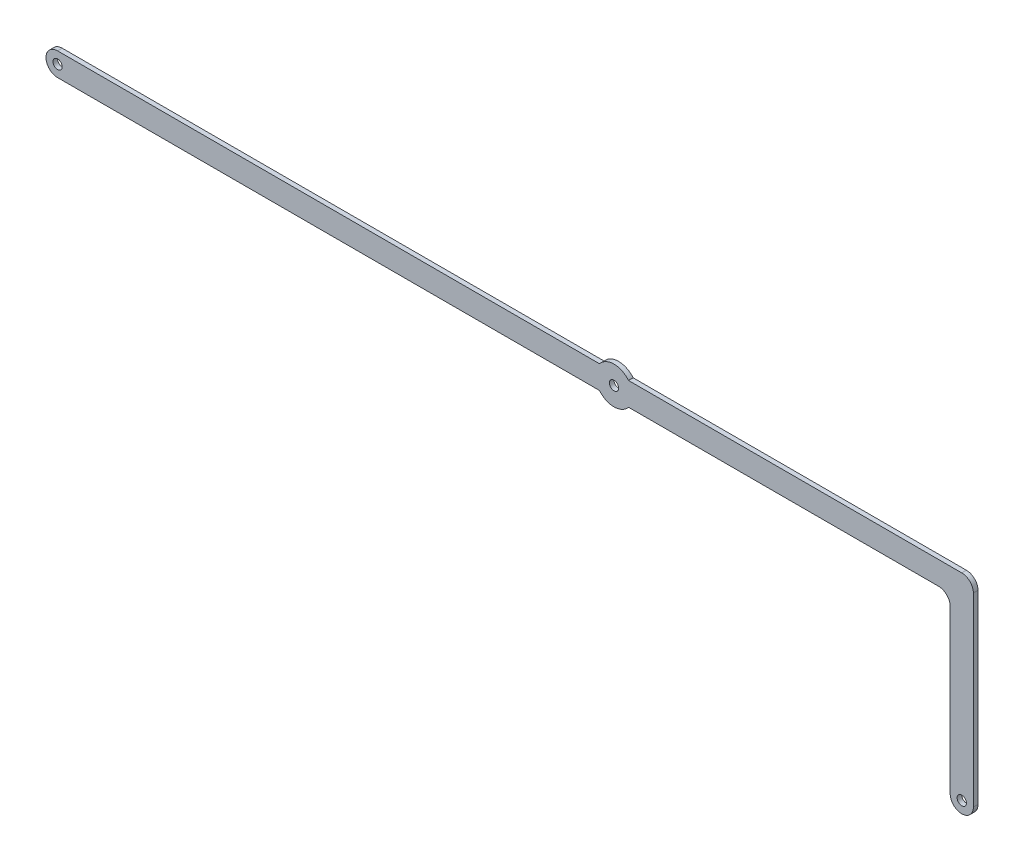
SolidWorks part; units mm, degrees
ref_plane "Front" through (0, 0, 0) normal (0, 0, 1) x (1, 0, 0)
ref_plane "Top" through (0, 0, 0) normal (0, 1, 0) x (1, 0, 0)
ref_plane "Right" through (0, 0, 0) normal (1, 0, 0) x (0, 0, -1)
sketch "Sketch1" plane through (0, 0, 0) normal (0, 0, 1) x (1, 0, 0)
  line L0 (0, 0) -> (120, 0) construction
  line L1 (120, 0) -> (195, 0) construction
  line L2 (195, 0) -> (195, -40) construction
  line L3 (0, -2.5) -> (116.8775, -2.5)
  line L4 (123.1225, -2.5) -> (190, -2.5)
  line L5 (192.5, -5) -> (192.5, -40)
  line L6 (0, 2.5) -> (116.8775, 2.5)
  line L7 (123.1225, 2.5) -> (195, 2.5)
  line L8 (197.5, 0) -> (197.5, -40)
  line L9 (192.5, -2.5) -> (192.5, -40) construction
  line L10 (120, -2.5) -> (192.5, -2.5) construction
  line L11 (197.5, 2.5) -> (197.5, -40) construction
  line L12 (120, 2.5) -> (197.5, 2.5) construction
  line L13 (0, 2.5) -> (120, 2.5) construction
  line L14 (0, -2.5) -> (120, -2.5) construction
  circle A0 centre (0, 0) radius 1
  circle A1 centre (120, 0) radius 1
  arc A2 (0, 2.5) -> (0, -2.5) centre (0, 0) ccw
  arc A3 (123.1225, 2.5) -> (116.8775, 2.5) centre (120, 0) ccw
  circle A4 centre (195, -40) radius 1
  arc A5 (192.5, -40) -> (197.5, -40) centre (195, -40) ccw
  arc A6 (192.5, -5) -> (190, -2.5) centre (190, -5) ccw
  arc A7 (197.5, 0) -> (195, 2.5) centre (195, 0) ccw
  arc A8 (116.8775, -2.5) -> (123.1225, -2.5) centre (120, 0) ccw
  dimension "D2" = 75
  dimension "D4" = 5
  dimension "D5" = 2.5
  dimension "D1" = 120
  dimension "D3" = 40
extrude "Extrude1" add sketch "Sketch1" along normal blind 1
